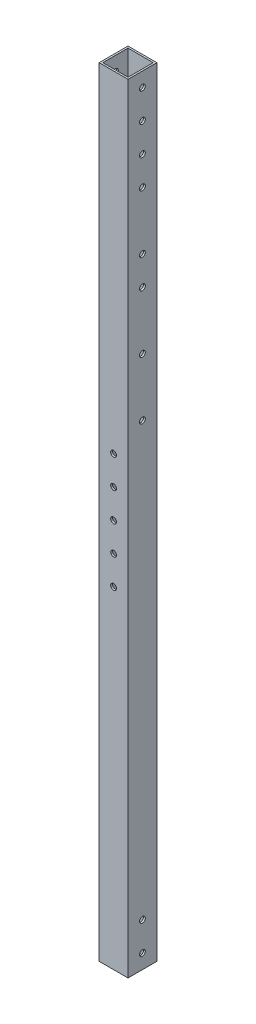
SolidWorks part; units mm, degrees
ref_plane "Front Plane" through (0, 0, 0) normal (0, 0, 1) x (1, 0, 0)
ref_plane "Top Plane" through (0, 0, 0) normal (0, 1, 0) x (1, 0, 0)
ref_plane "Right Plane" through (0, 0, 0) normal (1, 0, 0) x (0, 0, -1)
sketch "Sketch1" plane through (0, 0, 0) normal (0, 1, 0) x (1, 0, 0)
  line L1 (-12.7, -12.7) -> (12.7, -12.7)
  line L2 (-12.7, -12.7) -> (-12.7, 12.7)
  line L3 (-12.7, 12.7) -> (12.7, 12.7)
  line L4 (12.7, -12.7) -> (12.7, 12.7)
  line L5 (-12.7, -12.7) -> (12.7, 12.7) construction
  line L6 (-12.7, 12.7) -> (12.7, -12.7) construction
  line L7 (-11.1125, -11.1125) -> (11.1125, -11.1125)
  line L8 (-11.1125, -11.1125) -> (-11.1125, 11.1125)
  line L9 (-11.1125, 11.1125) -> (11.1125, 11.1125)
  line L10 (11.1125, -11.1125) -> (11.1125, 11.1125)
  line L11 (-11.1125, -11.1125) -> (11.1125, 11.1125) construction
  line L12 (-11.1125, 11.1125) -> (11.1125, -11.1125) construction
  point P0 (0, 0)
  point P6 (0, 0)
  dimension "D1" = 25.4
  dimension "D2" = 1.5875
extrude "Boss-Extrude1" add sketch "Sketch1" along normal blind 685.8
hole_wizard "#7 (0.201) Diameter Hole1" positions "Sketch2" profile "Sketch3" hole size "#7" standard "ANSI Inch"
sketch "Sketch2" plane through (0, 0, 12.7) normal (0, 0, 1) x (1, 0, 0)
  point P21 (0, 292.1)
  point P22 (0, 317.5)
  point P23 (0, 342.9)
  point P24 (0, 368.3)
  point P25 (0, 393.7)
  point P38 (0, 673.1)
  point P39 (0, 647.7)
  point P40 (0, 622.3)
  point P41 (0, 596.9)
  point P42 (0, 571.5)
  point P43 (0, 546.1)
  point P44 (0, 520.7)
  point P45 (0, 495.3)
  point P46 (0, 469.9)
  point P47 (0, 444.5)
  point P48 (0, 419.1)
  point P49 (0, 241.3)
  point P50 (0, 215.9)
  point P51 (0, 190.5)
  point P52 (0, 165.1)
  point P53 (0, 139.7)
  point P54 (0, 114.3)
  point P55 (0, 88.9)
  point P56 (0, 63.5)
  point P57 (0, 38.1)
  dimension "D1" = 292.1
  dimension "D3" = 25.4
  dimension "D2" = 25.4
  dimension "D4" = 25.4
  dimension "D5" = 25.4
sketch "Sketch3" plane through (0, 292.1, 12.7) normal (1, 0, 0) x (0, -1, 0)
  line L0 (0, 0) -> (0, 25.4)
  line L1 (0, 25.4) -> (2.5527, 25.4)
  line L2 (2.5527, 25.4) -> (2.5527, 0)
  line L5 (2.5527, 0) -> (0, 0)
  line L11 (0, -6.35) -> (0, 107.95) construction
  dimension "Thru Hole Dia." = 5.1054
  dimension "Thru Hole Depth" = 25.4
hole_wizard "#7 (0.201) Diameter Hole2" positions "Sketch4" profile "Sketch5" hole size "#7" standard "ANSI Inch"
sketch "Sketch4" plane through (12.7, 0, 0) normal (1, 0, 0) x (0, 0, -1)
  line L0 (-12.7, 0) -> (12.7, 0) construction
  point P0 (0, 12.7)
  point P12 (0, 38.1)
  point P35 (0, 622.3)
  point P36 (0, 647.7)
  point P37 (0, 673.1)
  point P39 (0, 596.9)
  point P40 (0, 571.5)
  point P41 (0, 546.1)
  point P42 (0, 520.7)
  point P43 (0, 495.3)
  point P44 (0, 469.9)
  point P45 (0, 444.5)
  point P46 (0, 419.1)
  point P47 (0, 393.7)
  point P48 (0, 368.3)
  point P49 (0, 342.9)
  point P50 (0, 317.5)
  point P51 (0, 292.1)
  point P52 (0, 266.7)
  point P53 (0, 241.3)
  point P54 (0, 215.9)
  point P55 (0, 190.5)
  point P56 (0, 165.1)
  point P57 (0, 139.7)
  point P58 (0, 114.3)
  point P59 (0, 88.9)
  point P60 (0, 63.5)
  point P61 (0, 596.9)
  point P63 (0, 520.7)
  point P66 (0, 546.1)
  point P70 (0, 469.9)
  point P74 (0, 419.1)
  dimension "D1" = 12.7
  dimension "D3" = 25.4
  dimension "D4" = 25.4
  dimension "D5" = 76.2
  dimension "D6" = 50.8
  dimension "D7" = 50.8
  dimension "D8" = 50.8
  dimension "D2" = 27
sketch "Sketch5" plane through (12.7, 12.7, 0) normal (0, 1, 0) x (0, 0, -1)
  line L0 (0, 0) -> (0, 25.4)
  line L1 (0, 25.4) -> (2.5527, 25.4)
  line L2 (2.5527, 25.4) -> (2.5527, 0)
  line L5 (2.5527, 0) -> (0, 0)
  line L11 (0, -6.35) -> (0, 107.95) construction
  dimension "Thru Hole Dia." = 5.1054
  dimension "Thru Hole Depth" = 25.4
